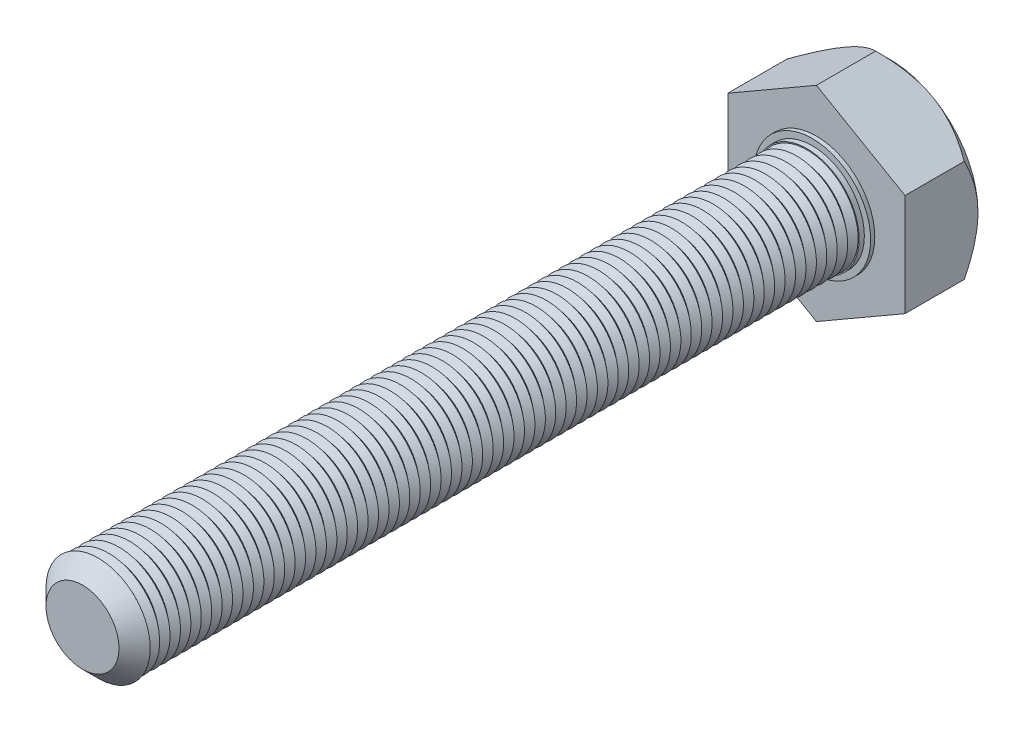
SolidWorks part; units mm, degrees
ref_plane "Front" through (0, 0, 0) normal (0, 0, 1) x (1, 0, 0)
ref_plane "Top" through (0, 0, 0) normal (0, 1, 0) x (1, 0, 0)
ref_plane "Right" through (0, 0, 0) normal (1, 0, 0) x (0, 0, -1)
sketch "Sketch1" plane through (0, 0, 0) normal (0, 0, 1) x (1, 0, 0)
  line L0 (0, 0) -> (0, 9.815) construction
  line L1 (0, 0) -> (-8.5, 0) construction
  line L2 (8.5, 4.9075) -> (8.5, -4.9075)
  line L3 (8.5, 4.9075) -> (0, 9.815)
  line L4 (-8.5, 4.9075) -> (0, 9.815)
  line L5 (-8.5, 4.9075) -> (-8.5, -4.9075)
  line L6 (-8.5, -4.9075) -> (0, -9.815)
  line L7 (8.5, -4.9075) -> (0, -9.815)
  point P12 (8.5, 0)
  dimension "D1" = 60
  dimension "s" = 17
extrude "Base-Extrude" add sketch "Sketch1" along normal mid plane 7
sketch "Sketch3" plane through (0, 0, 0) normal (0, 1, 0) x (1, 0, 0)
  line L1 (-8.5, 3.5) -> (0, 3.5) construction
  line L2 (-8.5, -3.5) -> (-8.5, 3.5) construction
  line L3 (-13.5, 3.5) -> (-8.5, 3.5)
  line L4 (-8.5, 3.5) -> (-13.5, -1.5)
  line L5 (-13.5, -1.5) -> (-13.5, 3.5)
  line L6 (0, 3.5) -> (0, -3.8824) construction
  dimension "D1" = 5
  dimension "D2" = 45
revolve "Cut-Revolve1" cut sketch "Sketch3" angle 360 about L6
sketch "Sketch5" plane through (0, 0, 3.5) normal (0, 0, 1) x (1, 0, 0)
  circle A0 centre (0, 0) radius 5.6
  dimension "dw" = 11.2
extrude "Boss-Extrude1" add sketch "Sketch5" along normal blind 0.4
sketch "Sketch6" plane through (0, 0, 3.9) normal (0, 0, 1) x (1, 0, 0)
  circle A0 centre (0, 0) radius 5
  dimension "d" = 10
extrude "Boss-Extrude2" add sketch "Sketch6" along normal blind 70
chamfer "Chamfer1" distance 1.5 angle 45 1 edges at (5, 0, 73.9)
sketch "Sketch7" plane through (0, 0, 0) normal (1, 0, 0) x (0, 0, -1)
  line L0 (-5.4, -4.9) -> (-5.4, -6.9)
  line L1 (-5.4, -6.9) -> (-4.4, -6.9)
  line L2 (-4.4, -6.9) -> (-4.4, -4.9)
  line L3 (-4.9, -4.3) -> (-5.4, -4.9)
  line L4 (-4.9, -4.3) -> (-4.4, -4.9)
  line L5 (0, 0) -> (-72.379, 0) construction
  line L8 (-3.9, 5.6) -> (-3.9, -5.6) construction
  point P12 (-4.9, -6.9)
  dimension "D1" = 1
  dimension "D2" = 2
  dimension "D3" = 2.6
  dimension "D4" = 0.5
  dimension "D5" = 4.3
revolve "Cut-Revolve2" cut sketch "Sketch7" angle 360 about L5
pattern_linear "LPattern1" count 68 spacing 1 along (0, 0, 1) of "Cut-Revolve2"
